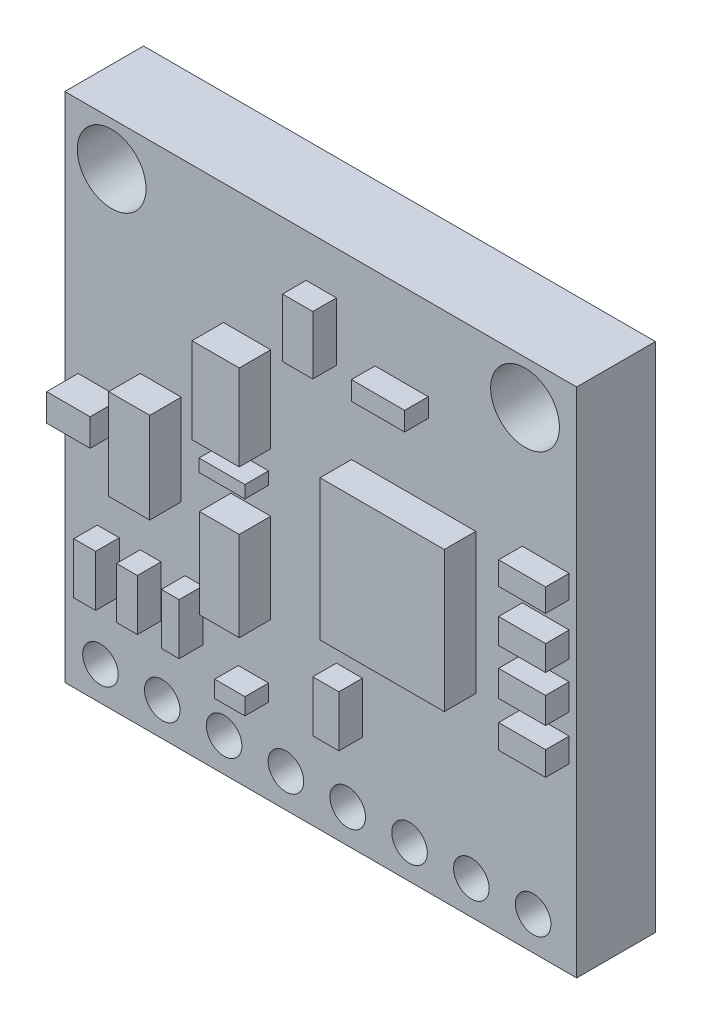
SolidWorks part; units mm, degrees
ref_plane "정면" through (0, 0, 0) normal (0, 0, 1) x (1, 0, 0)
ref_plane "윗면" through (0, 0, 0) normal (0, 1, 0) x (1, 0, 0)
ref_plane "우측면" through (0, 0, 0) normal (1, 0, 0) x (0, 0, -1)
sketch "스케치1" plane through (0, 0, 0) normal (0, 0, 1) x (1, 0, 0)
  line L1 (-62.6173, 11.6041) -> (-61.3173, 11.6041)
  line L2 (-62.6173, 11.6041) -> (-62.6173, 10.3041)
  line L3 (-62.6173, 10.3041) -> (-61.3173, 10.3041)
  line L4 (-61.3173, 11.6041) -> (-61.3173, 10.3041)
extrude "보스-돌출1" add sketch "스케치1" along normal blind 0.2
sketch "스케치2" plane through (0, 0, 0.2) normal (0, 0, 1) x (1, 0, 0)
  circle A0 centre (-62.5268, 10.3894) radius 0.0452
  circle A1 centre (-62.3698, 10.3894) radius 0.0452
  circle A2 centre (-62.2128, 10.3894) radius 0.0452
  circle A3 centre (-62.0558, 10.3894) radius 0.0452
  circle A4 centre (-61.8988, 10.3894) radius 0.0452
  circle A5 centre (-61.7418, 10.3894) radius 0.0452
  circle A6 centre (-61.5848, 10.3894) radius 0.0452
  circle A7 centre (-61.4278, 10.3894) radius 0.0452
  circle A8 centre (-62.4984, 11.4931) radius 0.0873
  circle A9 centre (-61.4484, 11.4931) radius 0.0873
  dimension "D1" = 8
  dimension "D2" = 2
extrude "컷-돌출1" cut sketch "스케치2" against normal blind 0.2
sketch "스케치3" plane through (0, 0, 0.2) normal (0, 0, 1) x (1, 0, 0)
  line L1 (-61.8892, 11.1585) -> (-61.5736, 11.1585)
  line L2 (-61.8892, 11.1585) -> (-61.8892, 10.8019)
  line L3 (-61.8892, 10.8019) -> (-61.5736, 10.8019)
  line L4 (-61.5736, 11.1585) -> (-61.5736, 10.8019)
  line L5 (-62.1954, 10.9313) -> (-62.0944, 10.9313)
  line L6 (-62.1954, 10.9313) -> (-62.1954, 10.704)
  line L7 (-62.1954, 10.704) -> (-62.0944, 10.704)
  line L8 (-62.0944, 10.9313) -> (-62.0944, 10.704)
  line L9 (-62.2143, 11.2974) -> (-62.0944, 11.2974)
  line L10 (-62.2143, 11.2974) -> (-62.2143, 11.0796)
  line L11 (-62.2143, 11.0796) -> (-62.0944, 11.0796)
  line L12 (-62.0944, 11.2974) -> (-62.0944, 11.0796)
  line L13 (-62.4258, 11.0796) -> (-62.3216, 11.0796)
  line L14 (-62.4258, 11.0796) -> (-62.4258, 10.8492)
  line L15 (-62.4258, 10.8492) -> (-62.3216, 10.8492)
  line L16 (-62.3216, 11.0796) -> (-62.3216, 10.8492)
  line L17 (-62.5836, 11.0007) -> (-62.4731, 11.0007)
  line L18 (-62.5836, 11.0007) -> (-62.5836, 10.9313)
  line L19 (-62.5836, 10.9313) -> (-62.4731, 10.9313)
  line L20 (-62.4731, 11.0007) -> (-62.4731, 10.9313)
extrude "보스-돌출2" add sketch "스케치3" along normal blind 0.08
sketch "스케치4" plane through (0, 0, 0.2) normal (0, 0, 1) x (1, 0, 0)
  line L1 (-62.0044, 11.495) -> (-61.9275, 11.495)
  line L2 (-62.0044, 11.495) -> (-62.0044, 11.3465)
  line L3 (-62.0044, 11.3465) -> (-61.9275, 11.3465)
  line L4 (-61.9275, 11.495) -> (-61.9275, 11.3465)
  line L5 (-61.8294, 11.3943) -> (-61.6942, 11.3943)
  line L6 (-61.8294, 11.3943) -> (-61.8294, 11.3465)
  line L7 (-61.8294, 11.3465) -> (-61.6942, 11.3465)
  line L8 (-61.6942, 11.3943) -> (-61.6942, 11.3465)
  line L9 (-61.4556, 11.1848) -> (-61.3363, 11.1848)
  line L10 (-61.4556, 11.1848) -> (-61.4556, 11.1265)
  line L11 (-61.4556, 11.1265) -> (-61.3363, 11.1265)
  line L12 (-61.3363, 11.1848) -> (-61.3363, 11.1265)
  line L13 (-61.4556, 11.0602) -> (-61.3363, 11.0602)
  line L14 (-61.4556, 11.0602) -> (-61.4556, 10.9965)
  line L15 (-61.4556, 10.9965) -> (-61.3363, 10.9965)
  line L16 (-61.3363, 11.0602) -> (-61.3363, 10.9965)
  line L17 (-61.4556, 10.9462) -> (-61.3363, 10.9462)
  line L18 (-61.4556, 10.9462) -> (-61.4556, 10.8799)
  line L19 (-61.4556, 10.8799) -> (-61.3363, 10.8799)
  line L20 (-61.3363, 10.9462) -> (-61.3363, 10.8799)
  line L21 (-61.4556, 10.8268) -> (-61.3363, 10.8268)
  line L22 (-61.4556, 10.8268) -> (-61.4556, 10.7659)
  line L23 (-61.4556, 10.7659) -> (-61.3363, 10.7659)
  line L24 (-61.3363, 10.8268) -> (-61.3363, 10.7659)
  line L25 (-62.5347, 10.6916) -> (-62.479, 10.6916)
  line L26 (-62.5347, 10.6916) -> (-62.5347, 10.5617)
  line L27 (-62.5347, 10.5617) -> (-62.479, 10.5617)
  line L28 (-62.479, 10.6916) -> (-62.479, 10.5617)
  line L29 (-62.426, 10.6916) -> (-62.373, 10.6916)
  line L30 (-62.426, 10.6916) -> (-62.426, 10.5617)
  line L31 (-62.426, 10.5617) -> (-62.373, 10.5617)
  line L32 (-62.373, 10.6916) -> (-62.373, 10.5617)
  line L33 (-62.312, 10.6916) -> (-62.2669, 10.6916)
  line L34 (-62.312, 10.6916) -> (-62.312, 10.5617)
  line L35 (-62.312, 10.5617) -> (-62.2669, 10.5617)
  line L36 (-62.2669, 10.6916) -> (-62.2669, 10.5617)
  line L37 (-62.1768, 10.5617) -> (-62.0999, 10.5617)
  line L38 (-62.1768, 10.5617) -> (-62.1768, 10.5193)
  line L39 (-62.1768, 10.5193) -> (-62.0999, 10.5193)
  line L40 (-62.0999, 10.5617) -> (-62.0999, 10.5193)
  line L41 (-61.9275, 10.6916) -> (-61.8612, 10.6916)
  line L42 (-61.9275, 10.6916) -> (-61.9275, 10.5617)
  line L43 (-61.9275, 10.5617) -> (-61.8612, 10.5617)
  line L44 (-61.8612, 10.6916) -> (-61.8612, 10.5617)
  line L45 (-62.2165, 11.0284) -> (-62.0999, 11.0284)
  line L46 (-62.2165, 11.0284) -> (-62.2165, 10.9965)
  line L47 (-62.2165, 10.9965) -> (-62.0999, 10.9965)
  line L48 (-62.0999, 11.0284) -> (-62.0999, 10.9965)
extrude "보스-돌출3" add sketch "스케치4" along normal blind 0.06
